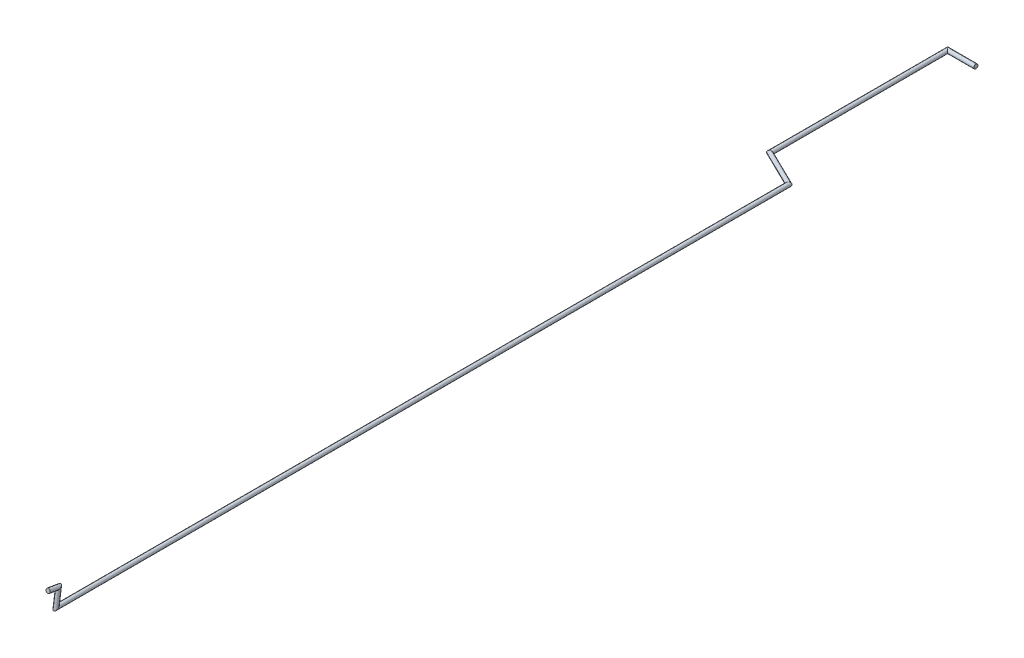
SolidWorks part; units mm, degrees
ref_plane "Plan de face" through (0, 0, 0) normal (0, 0, 1) x (1, 0, 0)
ref_plane "Plan de dessus" through (0, 0, 0) normal (0, 1, 0) x (1, 0, 0)
ref_plane "Plan de droite" through (0, 0, 0) normal (1, 0, 0) x (0, 0, -1)
sketch "Esquisse1" plane through (0, 0, 0) normal (1, 0, 0) x (0, 0, -1)
  line L0 (9.072, 0) -> (-17.3378, 0) construction
  line L1 (0, 7.581) -> (0, -2.4798) construction
  circle A0 centre (0, 0) radius 0.6
ref_plane "Plan1" through (0, 0, 0) normal (0, 1, 0) x (-1, 0, 0)
sketch3d "Esquisse3D1"
  line L0 (0, 0, 0) -> (-8.1, 0, 0)
  line L1 (-8.1, 0, 0) -> (-8.1, 0, 51)
  line L2 (-8.1, 0, 51) -> (2.4, 0, 56.1212)
  line L3 (2.4, 0, 56.1212) -> (2.4, 0, 266.267)
  line L4 (2.4, 0, 266.267) -> (2.4, 4.7259, 265.6087)
  line L7 (2.4, 4.7259, 265.6087) -> (2.4, 5.2157, 268.5685)
  dimension "D1" = 10.5
  dimension "D2" = 116
  dimension "D3" = 82.07
sweep "Balayage1" add profiles "Esquisse1" path "Esquisse3D1"
